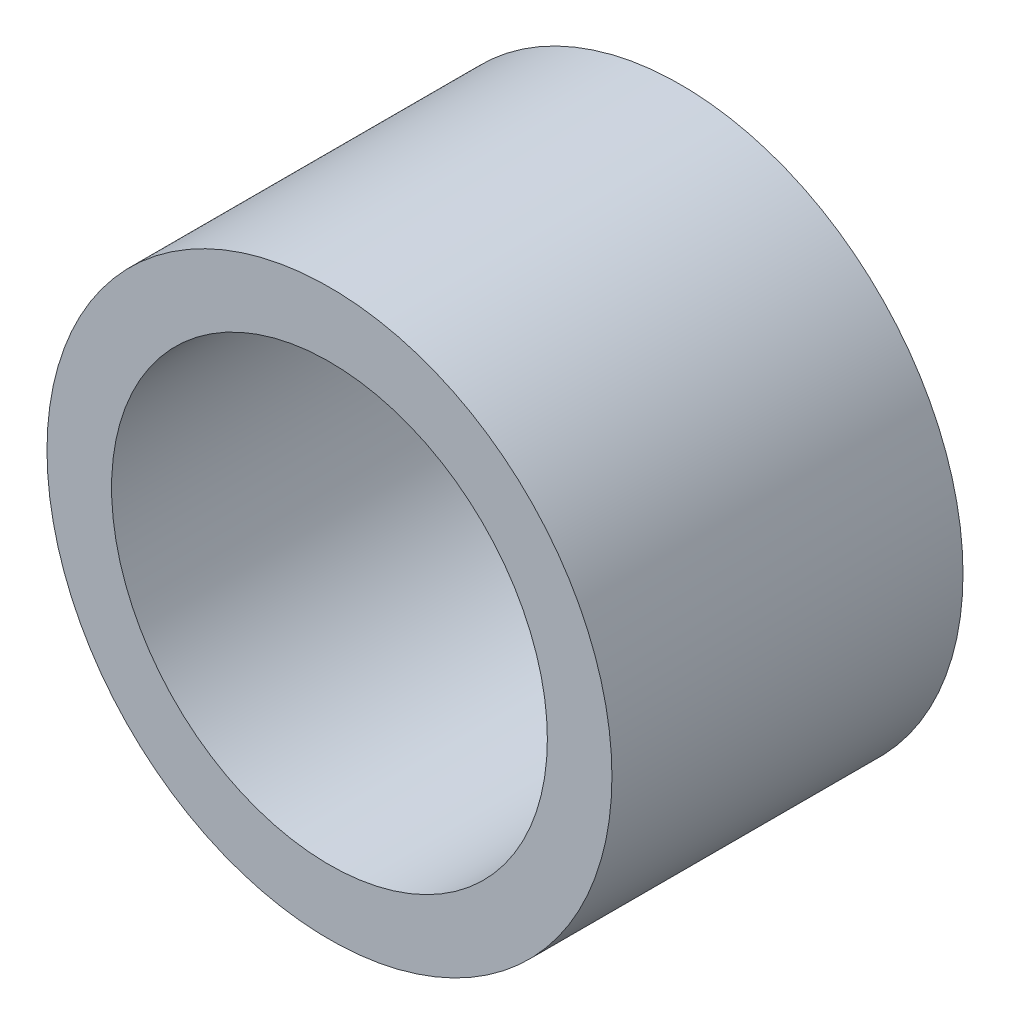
SolidWorks part; units mm, degrees
ref_plane "Face" through (0, 0, 0) normal (0, 0, 1) x (1, 0, 0)
ref_plane "Dessus" through (0, 0, 0) normal (0, 1, 0) x (1, 0, 0)
ref_plane "Droite" through (0, 0, 0) normal (1, 0, 0) x (0, 0, -1)
sketch "Esquisse1" plane through (0, 0, 0) normal (0, 0, 1) x (1, 0, 0)
  circle A0 centre (0, 0) radius 17.5
  circle A1 centre (0, 0) radius 13.5
  dimension "D1" = 27
  dimension "D2" = 35
extrude "Extrusion1" add sketch "Esquisse1" along normal blind 21.75
